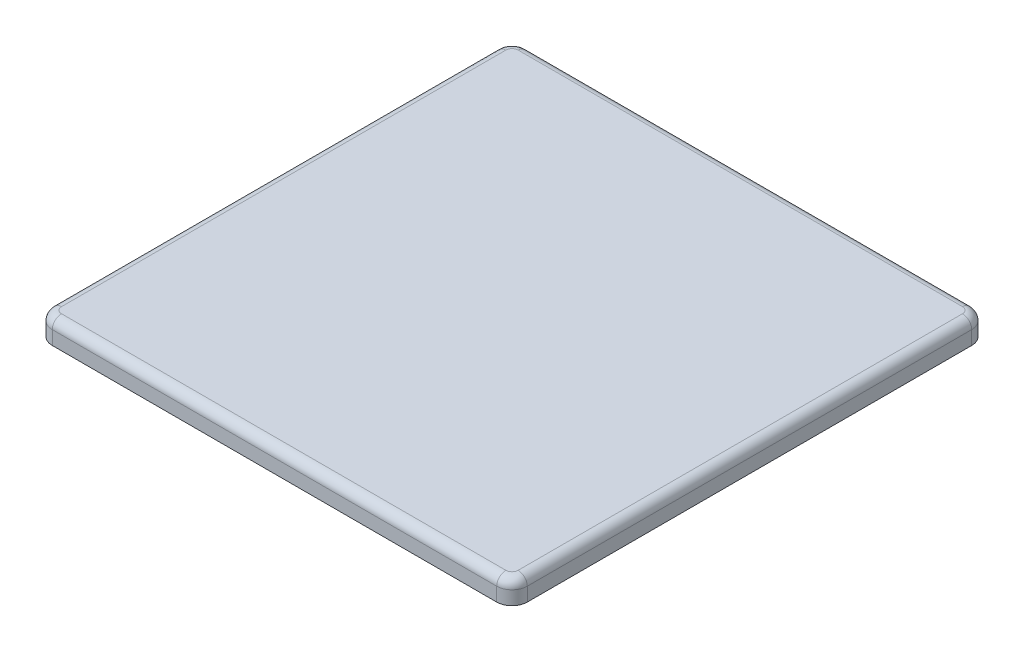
SolidWorks part; units mm, degrees
ref_plane "Front Plane" through (0, 0, 0) normal (0, 0, 1) x (1, 0, 0)
ref_plane "Top Plane" through (0, 0, 0) normal (0, 1, 0) x (1, 0, 0)
ref_plane "Right Plane" through (0, 0, 0) normal (1, 0, 0) x (0, 0, -1)
sketch "Sketch1" plane through (0, 0, 0) normal (0, 1, 0) x (1, 0, 0)
  line L1 (15.525, -15.525) -> (-15.525, -15.525)
  line L2 (15.525, -15.525) -> (15.525, 15.525)
  line L3 (15.525, 15.525) -> (-15.525, 15.525)
  line L4 (-15.525, -15.525) -> (-15.525, 15.525)
  line L5 (15.525, -15.525) -> (-15.525, 15.525) construction
  line L6 (15.525, 15.525) -> (-15.525, -15.525) construction
  point P0 (0, 0)
  dimension "D1" = 31.05
  dimension "D2" = 31.05
extrude "Boss-Extrude1" add sketch "Sketch1" along normal blind 1.5
fillet "Fillet3" radius 1 4 edges at (-15.525, 0.75, -15.525) (15.525, 0.75, -15.525) (15.525, 0.75, 15.525) (-15.525, 0.75, 15.525)
fillet "Fillet4" radius 0.6 8 edges at (-15.2321, 1.5, -15.2321) (0, 1.5, -15.525) (15.2321, 1.5, -15.2321) (15.525, 1.5, 0) (15.2321, 1.5, 15.2321) (0, 1.5, 15.525) (-15.2321, 1.5, 15.2321) (-15.525, 1.5, 0)
sketch "Sketch3" plane through (0, 0, 0) normal (0, -1, 0) x (1, 0, 0)
  line L0 (-15.525, -14.525) -> (-15.525, 14.525) construction
  line L1 (-14.525, 15.525) -> (14.525, 15.525) construction
  line L2 (0, 15.525) -> (0, -15.525) construction
  line L3 (14.525, -15.525) -> (-14.525, -15.525) construction
  line L4 (-15.525, 0) -> (15.525, 0) construction
  line L5 (15.525, 14.525) -> (15.525, -14.525) construction
  circle A0 centre (-7.525, 9.025) radius 3
  circle A1 centre (7.525, 9.025) radius 3
  circle A2 centre (7.525, -9.025) radius 3
  circle A3 centre (-7.525, -9.025) radius 3
  circle A4 centre (-7.525, 0) radius 3
  circle A5 centre (7.525, 0) radius 3
  dimension "D1" = 6
  dimension "D4" = 6
  dimension "D2" = 8
  dimension "D3" = 6.5
  dimension "D5" = 8
extrude "Cut-Extrude1" cut sketch "Sketch3" against normal blind 0.7
fillet "Fillet5" radius 1 6 edges at (-7.525, 0, -6.025) (7.525, 0, -12.025) (7.525, 0, 3) (7.525, 0, 12.025) (-7.525, 0, -3) (-7.525, 0, 6.025)
